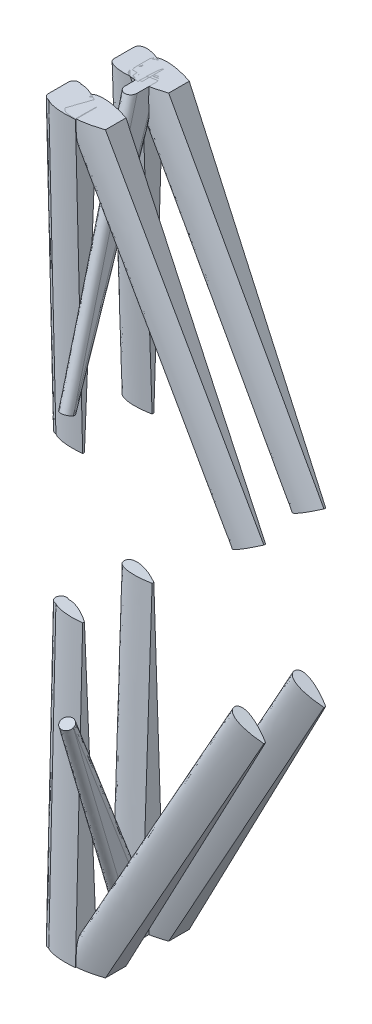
SolidWorks part; units mm, degrees
ref_plane "Piano frontale" through (0, 0, 0) normal (0, 0, 1) x (1, 0, 0)
ref_plane "Piano superiore" through (0, 0, 0) normal (0, 1, 0) x (1, 0, 0)
ref_plane "Piano destro" through (0, 0, 0) normal (1, 0, 0) x (0, 0, -1)
imported_body "Importato1"
imported_body "Importato2"
imported_body "Importato3"
imported_body "Importato4"
imported_body "Importato5"
mirror "Specchia1" about plane through (0, 0, 0) normal (0, 1, 0)
